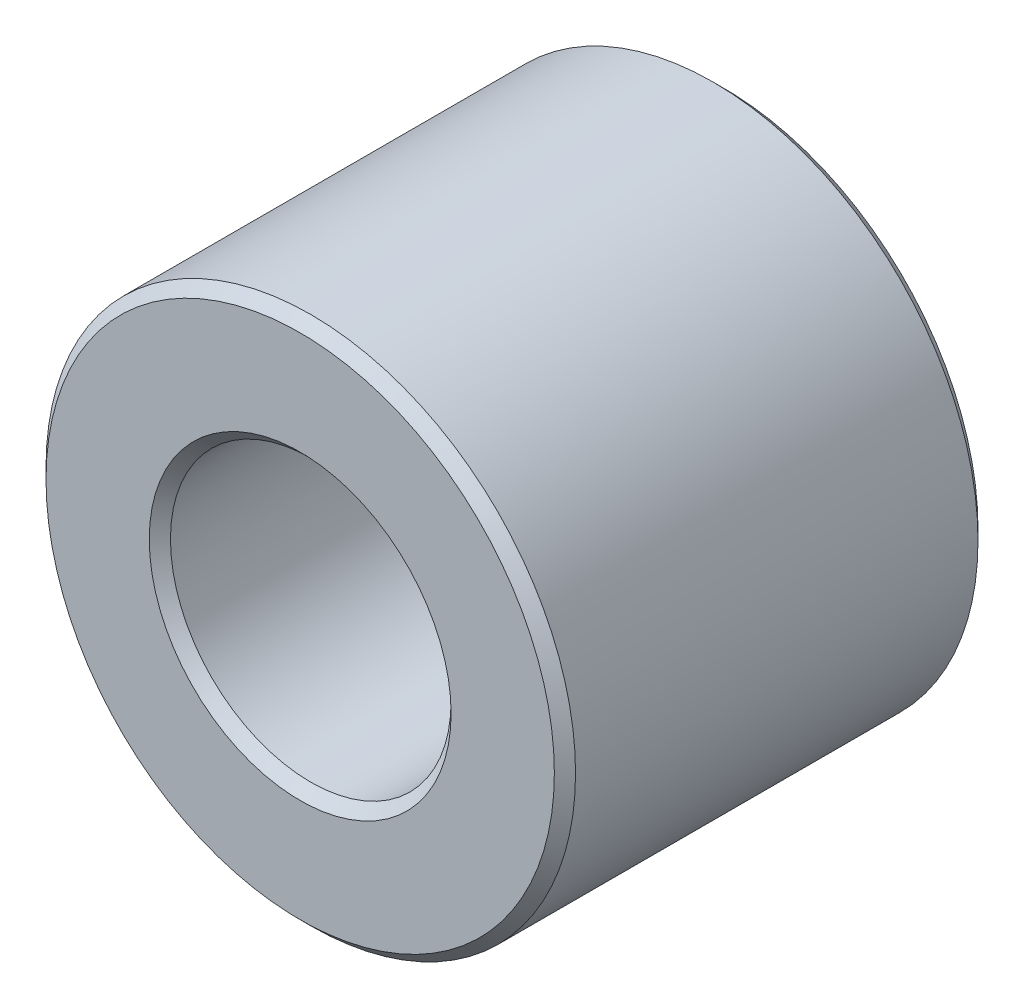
SolidWorks part; units mm, degrees
ref_plane "Front Plane" through (0, 0, 0) normal (0, 0, 1) x (1, 0, 0)
ref_plane "Top Plane" through (0, 0, 0) normal (0, 1, 0) x (1, 0, 0)
ref_plane "Right Plane" through (0, 0, 0) normal (1, 0, 0) x (0, 0, -1)
sketch "Sketch1" plane through (0, 0, 0) normal (0, 0, 1) x (1, 0, 0)
  circle A0 centre (0, 0) radius 5
  circle A1 centre (0, 0) radius 2.65
  dimension "D1" = 10
  dimension "D2" = 5.3
extrude "Boss-Extrude2" add sketch "Sketch1" along normal mid plane 8
chamfer "Chamfer3" distance 0.2 angle 45 4 edges at (5, 0, 4) (5, 0, -4) (2.65, 0, -4) (2.65, 0, 4)
